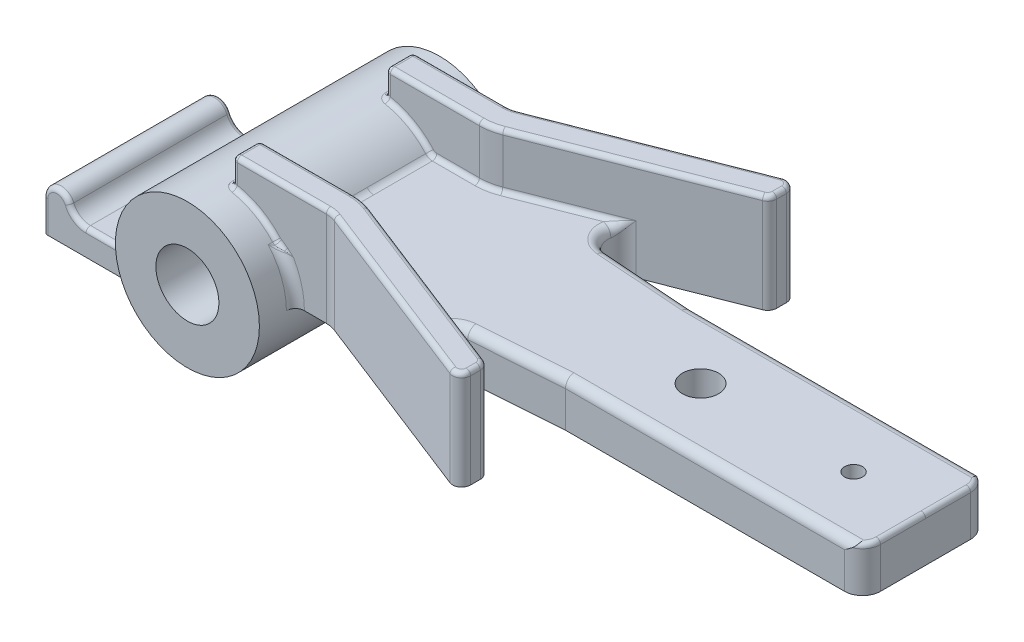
SolidWorks part; units mm, degrees
ref_plane "Plan1" through (0, 0, 0) normal (0, 0, 1) x (1, 0, 0)
ref_plane "Plan2" through (0, 0, 0) normal (0, 1, 0) x (1, 0, 0)
ref_plane "Plan3" through (0, 0, 0) normal (1, 0, 0) x (0, 0, -1)
sketch "Esquisse1" plane through (0, 0, 0) normal (0, 0, 1) x (1, 0, 0)
  circle A0 centre (0, 0) radius 8
  dimension "D2" = 16
extrude "Base-Extrusion" add sketch "Esquisse1" along normal blind 14
sketch "Esquisse2" plane through (0, 0, 0) normal (0, 1, 0) x (1, 0, 0)
  line L0 (0, 0) -> (41, 0)
  line L1 (68, 0) -> (68, -7)
  line L2 (68, -7) -> (35, -7)
  line L3 (35, -7) -> (35, -19)
  line L4 (0, -10) -> (12, -10)
  line L5 (0, 0) -> (0, -10)
  line L6 (45, 0) -> (59, 0)
  line L7 (61, 0) -> (68, 0)
  line L8 (12, -10) -> (35, -19)
  arc A2 (59, 0) -> (61, 0) centre (60, 0) ccw
  arc A3 (41, 0) -> (45, 0) centre (43, 0) ccw
  dimension "D7" = 2
  dimension "D9" = 4
  dimension "D6" = 17
  dimension "D2" = 33
  dimension "D3" = 19
  dimension "D5" = 68
  dimension "D8" = 60
  dimension "D10" = 7
  dimension "D11" = 10
extrude "Boss.-Extru.1" add sketch "Esquisse2" along normal blind 5
sketch "Esquisse5" plane through (0, 0, 0) normal (0, 0, -1) x (-1, 0, 0)
  line L15 (0, -8) -> (21, -8)
  line L16 (21, -8) -> (21, -4.5)
  line L17 (16.2587, -5.1793) -> (9, -5.1793)
  line L18 (8, -4.1793) -> (8, 0)
  line L19 (8, 0) -> (0, -8)
  line L20 (0, -8) -> (21, -8)
  line L21 (21, -8) -> (21, -4.5)
  line L22 (16.2587, -5.1793) -> (9, -5.1793)
  line L23 (8, -4.1793) -> (8, 0)
  line L24 (8, 0) -> (0, -8)
  arc A9 (21, -4.5) -> (18.1109, -3.934) centre (19.5, -4.5) ccw
  arc A10 (16.2587, -5.1793) -> (18.1109, -3.934) centre (16.2587, -3.1793) ccw
  arc A11 (8, -4.1793) -> (9, -5.1793) centre (9, -4.1793) ccw
  arc A12 (21, -4.5) -> (18.1109, -3.934) centre (19.5, -4.5) ccw
  arc A13 (16.2587, -5.1793) -> (18.1109, -3.934) centre (16.2587, -3.1793) ccw
  arc A14 (8, -4.1793) -> (9, -5.1793) centre (9, -4.1793) ccw
  dimension "D1" = 0
fillet "Congé3" radius 2
fillet "Congé6" radius 1
fillet "Congé4" radius 0.5
sketch "Esquisse4" plane through (0, 0, 14) normal (0, 0, 1) x (1, 0, 0)
  line L0 (0, -8) -> (-21, -8)
  line L1 (-21, -8) -> (-21, -4.5)
  line L4 (-16.2587, -5.1793) -> (-9, -5.1793)
  line L5 (-8, -4.1793) -> (-8, 0)
  line L6 (-8, 0) -> (0, -8)
  circle A0 centre (0, 0) radius 8 construction
  arc A1 (-18.1109, -3.934) -> (-21, -4.5) centre (-19.5, -4.5) ccw
  arc A2 (-16.2587, -5.1793) -> (-18.1109, -3.934) centre (-16.2587, -3.1793) cw
  arc A3 (-8, -4.1793) -> (-9, -5.1793) centre (-9, -4.1793) cw
  dimension "D2" = 3
  dimension "D3" = 2
  dimension "D4" = 1
  dimension "D1" = 21
extrude "BEC" add sketch "Esquisse5" against normal blind 9
sketch "Esquisse7" plane through (0, 0, 0) normal (0, -1, 0) x (1, 0, 0)
  line L0 (12.5661, 7) -> (34.3644, 15.5298)
  line L1 (1.0434, 7) -> (12.5661, 7)
  line L2 (1.0434, 10) -> (1.0434, 7)
  line L3 (35, 17.5349) -> (35, 16.461)
  line L5 (1.0434, 10) -> (12, 10)
  line L6 (12.1757, 10.0688) -> (33.6356, 18.4661) construction
  line L7 (12, 10) -> (33.6356, 18.4661)
  arc A0 (35, 17.5349) -> (33.6356, 18.4661) centre (34, 17.5349) ccw construction
  arc A1 (35, 17.5349) -> (33.6356, 18.4661) centre (34, 17.5349) ccw
  arc A2 (34.3644, 15.5298) -> (35, 16.461) centre (34, 16.461) ccw
  dimension "D2" = 1
  dimension "D1" = 3
extrude "nervure de départ" add sketch "Esquisse7" against normal blind 11
sketch "Esquisse11" plane through (0, 0, 0) normal (0, 0, -1) x (-1, 0, 0)
  circle A0 centre (0, 0) radius 3.5
  dimension "D1" = 7
extrude "alésage" cut sketch "Esquisse11" against normal through all
ref_plane "Plan5" through (0, 0, 0) normal (-0.866, 0.5, 0) x (0, 0, 1)
sketch "Esquisse12" plane through (0, 0, 0) normal (-0.866, 0.5, 0) x (0, 0, 1)
  circle A0 centre (0, 0) radius 1
  dimension "D1" = 2
extrude "trou goupille" cut sketch "Esquisse12" against normal through all and the other way through all
fillet "Congés du bec" radius 0.5
sketch "Esquisse14" plane through (0, 5, 0) normal (0, 1, 0) x (-1, 0, 0)
  line L0 (-35, 7) -> (-24.8578, 7.7228)
  line L1 (-12.5661, 7) -> (-34.3644, 15.5298) construction
  line L2 (-24.2712, 11.5803) -> (-34.3644, 15.5298)
  line L3 (-35, 7) -> (-35, 16.461) construction
  line L4 (-35, 7) -> (-35, 16.461)
  arc A0 (-24.8578, 7.7228) -> (-24.2712, 11.5803) centre (-25, 9.7178) ccw
  arc A1 (-35, 16.461) -> (-34.3644, 15.5298) centre (-34, 16.461) ccw construction
  arc A2 (-35, 16.461) -> (-34.3644, 15.5298) centre (-34, 16.461) ccw
  dimension "D1" = 4
  dimension "D2" = 10
extrude "Enlèv. mat.-Extru.1" cut sketch "Esquisse14" against normal through all
fillet "Congé13" radius 3
fillet "Congé14" radius 6
fillet "Congé21" radius 0.5
fillet "Congé23" radius 1
mirror "Symétrie1"
fillet "Congé25" radius 0.5
sketch "Esquisse16" plane through (0, 0, 0) normal (0, -1, 0) x (1, 0, 0)
  circle A0 centre (25, 0) radius 2.5
  dimension "D1" = 5
  dimension "D2" = 25
extrude "Extrusion1" add sketch "Esquisse16" along normal blind 5 draft 10
